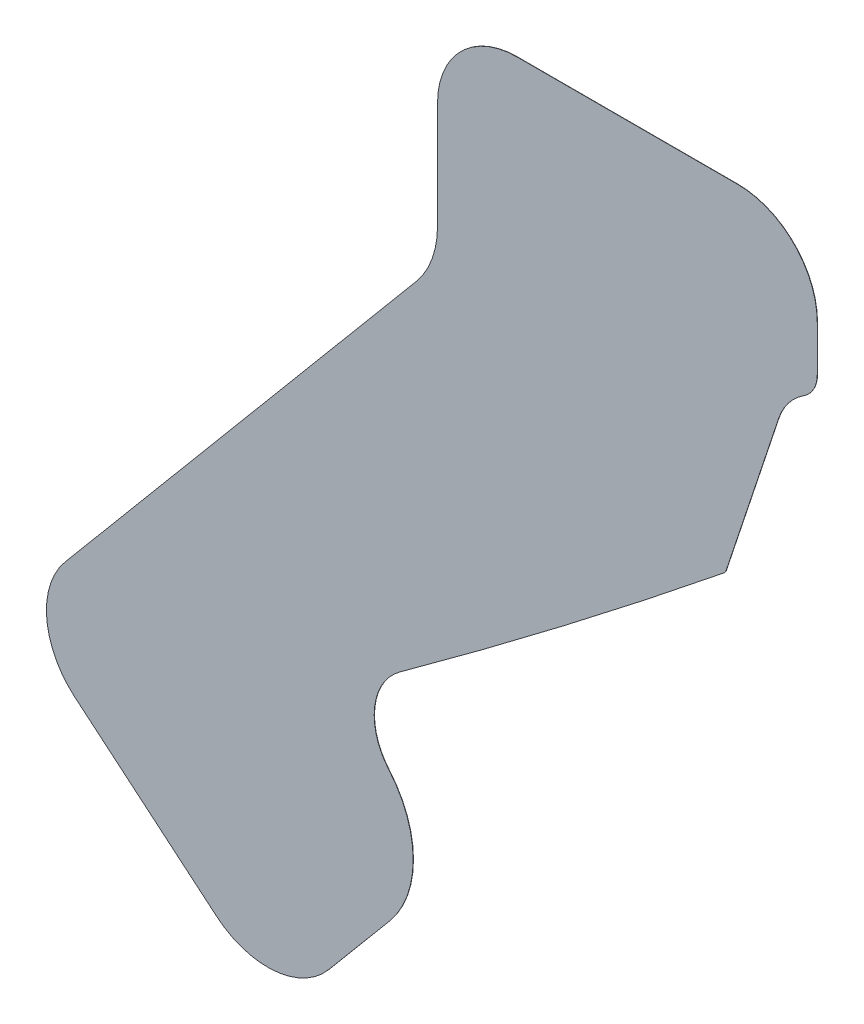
SolidWorks part; units mm, degrees
ref_plane "Front" through (0, 0, 0) normal (0, 0, 1) x (1, 0, 0)
ref_plane "Top" through (0, 0, 0) normal (0, 1, 0) x (1, 0, 0)
ref_plane "Right" through (0, 0, 0) normal (1, 0, 0) x (0, 0, -1)
sketch "Sketch1" plane through (0, 0, 0) normal (0, 0, 1) x (1, 0, 0)
  line L89 (-509.2085, -92.7007) -> (-503.7738, -86.2239)
  line L90 (-473.7316, -44.1251) -> (-469.0376, -30.007)
  line L91 (-465.582, -24.8751) -> (-465.582, -20.8192)
  line L92 (-472.694, -13.7072) -> (-492.379, -13.7072)
  line L93 (-499.491, -20.8192) -> (-499.491, -30.3479)
  line L94 (-501.3926, -35.5724) -> (-532.7521, -72.9453)
  line L95 (-531.8755, -82.9649) -> (-519.2281, -93.5773)
  line L96 (-509.2085, -92.7007) -> (-503.7738, -86.2239)
  line L97 (-473.7316, -44.1251) -> (-469.0376, -30.007)
  line L98 (-465.582, -24.8751) -> (-465.582, -20.8192)
  line L99 (-472.694, -13.7072) -> (-492.379, -13.7072)
  line L100 (-499.491, -20.8192) -> (-499.491, -30.3479)
  line L101 (-501.3926, -35.5724) -> (-532.7521, -72.9453)
  line L102 (-531.8755, -82.9649) -> (-519.2281, -93.5773)
  arc A116 (-503.7738, -86.2239) -> (-503.8237, -74.573) centre (-510.6813, -80.4279) ccw
  arc A117 (-502.8625, -66.5113) -> (-503.8237, -74.573) centre (-499.6222, -70.9858) ccw
  arc A118 (-502.8625, -66.5113) -> (-473.8946, -44.3602) centre (-912.9773, 499.8274) ccw
  arc A119 (-473.8946, -44.3602) -> (-473.7316, -44.1251) centre (-474.2136, -43.9648) ccw
  arc A120 (-466.7989, -27.1134) -> (-469.0376, -30.007) centre (-463.7952, -31.75) ccw
  arc A121 (-466.7989, -27.1134) -> (-465.582, -24.8751) centre (-468.249, -24.8751) ccw
  arc A122 (-465.582, -20.8192) -> (-472.694, -13.7072) centre (-472.694, -20.8192) ccw
  arc A123 (-492.379, -13.7072) -> (-499.491, -20.8192) centre (-492.379, -20.8192) ccw
  arc A124 (-501.3926, -35.5724) -> (-499.491, -30.3479) centre (-507.619, -30.3479) ccw
  arc A125 (-532.7521, -72.9453) -> (-531.8755, -82.9649) centre (-527.304, -77.5168) ccw
  arc A126 (-519.2281, -93.5773) -> (-509.2085, -92.7007) centre (-514.6566, -88.1292) ccw
  arc A127 (-503.7738, -86.2239) -> (-503.8237, -74.573) centre (-510.6813, -80.4279) ccw
  arc A128 (-502.8625, -66.5113) -> (-503.8237, -74.573) centre (-499.6222, -70.9858) ccw
  arc A129 (-502.8625, -66.5113) -> (-473.8946, -44.3602) centre (-912.9773, 499.8274) ccw
  arc A130 (-473.8946, -44.3602) -> (-473.7316, -44.1251) centre (-474.2136, -43.9648) ccw
  arc A131 (-466.7989, -27.1134) -> (-469.0376, -30.007) centre (-463.7952, -31.75) ccw
  arc A132 (-466.7989, -27.1134) -> (-465.582, -24.8751) centre (-468.249, -24.8751) ccw
  arc A133 (-465.582, -20.8192) -> (-472.694, -13.7072) centre (-472.694, -20.8192) ccw
  arc A134 (-492.379, -13.7072) -> (-499.491, -20.8192) centre (-492.379, -20.8192) ccw
  arc A135 (-501.3926, -35.5724) -> (-499.491, -30.3479) centre (-507.619, -30.3479) ccw
  arc A136 (-532.7521, -72.9453) -> (-531.8755, -82.9649) centre (-527.304, -77.5168) ccw
  arc A137 (-519.2281, -93.5773) -> (-509.2085, -92.7007) centre (-514.6566, -88.1292) ccw
  dimension "D1" = 0.508
extrude "Boss-Extrude1" add sketch "Sketch1" along normal blind 0.0254 separate body
